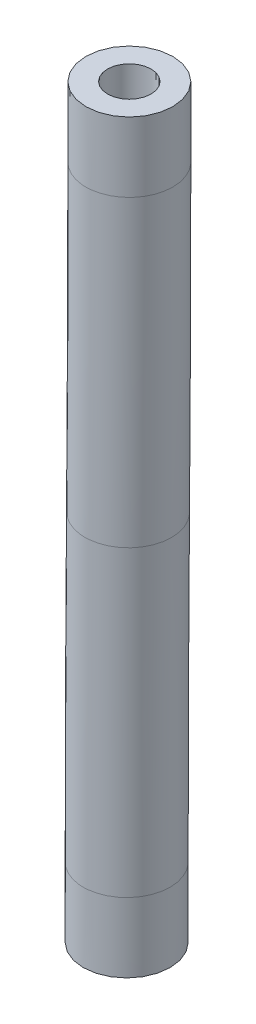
SolidWorks part; units mm, degrees
ref_plane "Front" through (0, 0, 0) normal (0, 0, 1) x (1, 0, 0)
ref_plane "Top" through (0, 0, 0) normal (0, 1, 0) x (1, 0, 0)
ref_plane "Right" through (0, 0, 0) normal (1, 0, 0) x (0, 0, -1)
sketch "Sketch1" plane through (0, 0, 0) normal (0, 1, 0) x (1, 0, 0)
  circle A0 centre (0, 0) radius 1.5875
  circle A1 centre (0, 0) radius 3.175
  dimension "D1" = 1.5875
  dimension "D2" = 6.35
sketch "Sketch2" plane through (0, 0, 0) normal (0, 0, 1) x (1, 0, 0)
  line L0 (0, 0) -> (0, 5.08)
  line L1 (3.175, 0) -> (-3.175, 0) construction
  line L2 (0.1934, 49.4108) -> (0.1934, 54.4908)
  line L3 (2540, 5.08) -> (0.0967, 27.2454) construction
  line L4 (2540, 5.08) -> (0, 5.08) construction
  line L5 (0.1934, 49.4108) -> (-2539.8066, 49.4108) construction
  line L6 (-2539.8066, 49.4108) -> (0.0967, 27.2454) construction
  arc A0 (0, 5.08) -> (0.0967, 27.2454) centre (2540, 5.08) cw
  arc A1 (0.0967, 27.2454) -> (0.1934, 49.4108) centre (-2539.8066, 49.4108) ccw
  dimension "D2" = 0.5
  dimension "D1" = 5.08
  dimension "D3" = 0.5
  dimension "D4" = 5.08
  dimension "D5" = 2540
  dimension "D6" = 2540
  dimension "D7" = 54.4908
sweep "Sweep1" add profiles "Sketch1" path "Sketch2"
